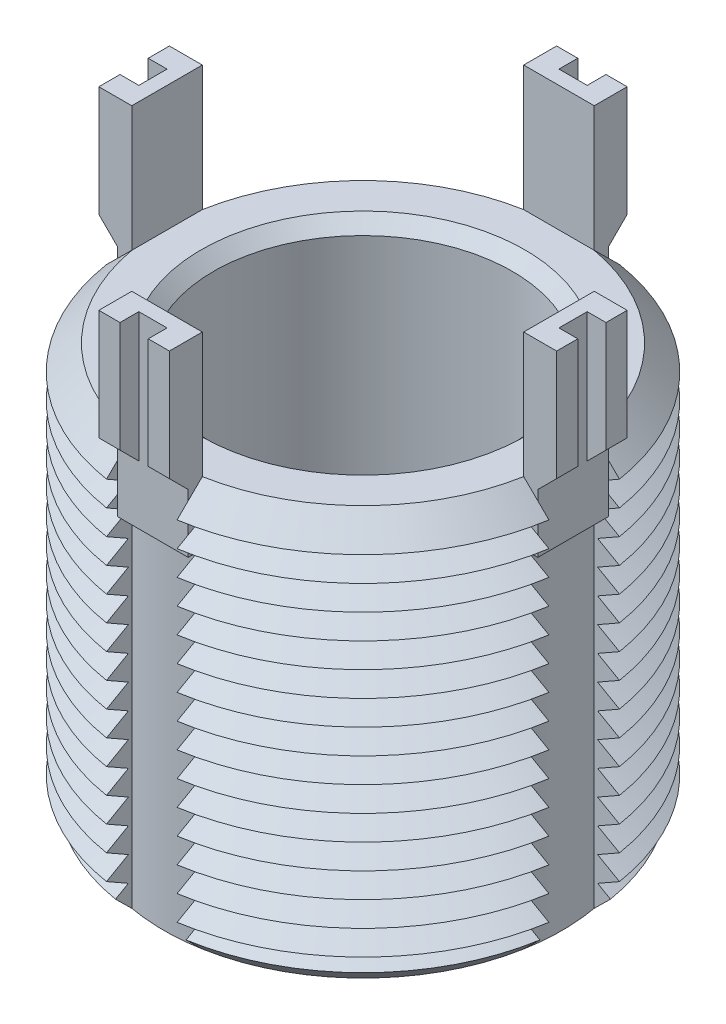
SolidWorks part; units mm, degrees
ref_plane "Front Plane" through (0, 0, 0) normal (0, 0, 1) x (1, 0, 0)
ref_plane "Top Plane" through (0, 0, 0) normal (0, 1, 0) x (1, 0, 0)
ref_plane "Right Plane" through (0, 0, 0) normal (1, 0, 0) x (0, 0, -1)
sketch "Sketch1" plane through (0, 0, 0) normal (0, 1, 0) x (1, 0, 0)
  circle A0 centre (0, 0) radius 19.05
  dimension "D1" = 38.1
extrude "Boss-Extrude1" add sketch "Sketch1" against normal blind 34.798
chamfer "Chamfer1" distance 2.117 angle 45 2 edges at (0, -34.798, 19.05) (0, 0, 19.05)
sketch "Sketch2" plane through (0, 0, 0) normal (1, 0, 0) x (0, 0, -1)
  line L0 (0, 0.8859) -> (0, -9.2617) construction
sketch "Sketch3" plane through (0, 0, 0) normal (1, 0, 0) x (0, 0, -1)
  line L0 (-19.05, -2.117) -> (-17.2166, -3.1755)
  line L1 (-17.2166, -3.1755) -> (-19.05, -4.234)
  line L2 (-19.05, -2.117) -> (-19.05, -32.681) construction
  line L3 (-19.05, -4.234) -> (-19.05, -2.117)
  dimension "D1" = 2.117
revolve "Cut-Revolve1" cut sketch "Sketch3" angle 360 about L0
pattern_linear "LPattern1" count 15 spacing 2.117 along (0, -1, 0) of "Cut-Revolve1"
sketch "Sketch4" plane through (0, 0, 0) normal (0, 1, 0) x (1, 0, 0)
  line L0 (-16.6651, 3) -> (-18.8123, 3)
  line L2 (-18.8123, -3) -> (-16.6651, -3)
  arc A0 (-16.6651, 3) -> (-16.6651, -3) centre (0, 0) ccw
  arc A1 (-18.8123, 3) -> (-18.8123, -3) centre (0, 0) ccw
  circle A2 centre (0, 0) radius 19.05 construction
  circle A3 centre (0, 0) radius 16.933 construction
  point P1 (-16.933, 0)
  point P3 (-19.05, 0)
  point P13 (0, 0)
  dimension "D1" = 6
extrude "Cut-Extrude1" cut sketch "Sketch4" against normal up to surface (34.798 mm away)
pattern_circular "CirPattern1" count 4 over 360 about axis through (0, 0, 0) along (0, 1, 0) of "Cut-Extrude1"
sketch "Sketch5" plane through (0, 0, 0) normal (1, 0, 0) x (0, 0, -1)
  line L0 (-16.6651, 10.649) -> (-16.6651, -5.351)
  line L1 (-16.6651, -5.351) -> (-17.8651, -5.351)
  line L2 (-17.8651, -5.351) -> (-17.8651, -0.351)
  line L3 (-17.8651, -0.351) -> (-19.4651, 1.249)
  line L4 (-19.4651, 1.249) -> (-19.4651, 10.649)
  line L5 (-19.4651, 10.649) -> (-16.6651, 10.649)
  line L6 (-18.8123, -6.351) -> (-3, -6.351) construction
  point P9 (-3, 0)
  point P10 (-17.8651, -0.351)
  dimension "D1" = 1
  dimension "D2" = 16
  dimension "D3" = 11
  dimension "D4" = 2.8
  dimension "D5" = 1.2
  dimension "D6" = 45
extrude "Boss-Extrude3" add sketch "Sketch5" along normal mid plane 6
pattern_circular "CirPattern2" count 4 over 360 about axis through (0, 0, 0) along (0, 1, 0) of "Boss-Extrude3"
sketch "Sketch6" plane through (0, 10.649, 0) normal (0, 1, 0) x (1, 0, 0)
  line L0 (-19.4651, -3) -> (-19.4651, 3) construction
  line L1 (-19.4651, -1.2) -> (-17.8651, -1.2)
  line L2 (-19.4651, -1.2) -> (-19.4651, 1.2)
  line L3 (-19.4651, 1.2) -> (-17.8651, 1.2)
  line L4 (-17.8651, -1.2) -> (-17.8651, 1.2)
  line L5 (-19.4651, -1.2) -> (-17.8651, 1.2) construction
  line L6 (-19.4651, 1.2) -> (-17.8651, -1.2) construction
  line L7 (19.4651, 3) -> (19.4651, -3) construction
  line L8 (-1.2, 17.8651) -> (1.2, 17.8651)
  line L9 (-1.2, 17.8651) -> (-1.2, 19.4651)
  line L10 (-1.2, 19.4651) -> (1.2, 19.4651)
  line L11 (1.2, 17.8651) -> (1.2, 19.4651)
  line L12 (-1.2, 17.8651) -> (1.2, 19.4651) construction
  line L13 (-1.2, 19.4651) -> (1.2, 17.8651) construction
  line L14 (17.8651, -1.2) -> (19.4651, -1.2)
  line L15 (17.8651, -1.2) -> (17.8651, 1.2)
  line L16 (17.8651, 1.2) -> (19.4651, 1.2)
  line L17 (19.4651, -1.2) -> (19.4651, 1.2)
  line L18 (17.8651, -1.2) -> (19.4651, 1.2) construction
  line L19 (17.8651, 1.2) -> (19.4651, -1.2) construction
  line L20 (-1.2, -19.4651) -> (1.2, -19.4651)
  line L21 (-1.2, -19.4651) -> (-1.2, -17.8651)
  line L22 (-1.2, -17.8651) -> (1.2, -17.8651)
  line L23 (1.2, -19.4651) -> (1.2, -17.8651)
  line L24 (-1.2, -19.4651) -> (1.2, -17.8651) construction
  line L25 (-1.2, -17.8651) -> (1.2, -19.4651) construction
  line L26 (-3, 19.4651) -> (3, 19.4651) construction
  line L27 (3, -19.4651) -> (-3, -19.4651) construction
  point P0 (-18.6651, 0)
  point P7 (-19.4651, 0)
  point P8 (-19.4651, 0)
  point P9 (0, 18.6651)
  point P14 (18.6651, 0)
  point P19 (0, -18.6651)
  point P24 (0, 19.4651)
  point P25 (19.4651, 0)
  point P26 (19.4651, 0)
  point P27 (0, 19.4651)
  point P30 (0, -19.4651)
  point P33 (0, -19.4651)
  dimension "D1" = 2.4
  dimension "D2" = 1.6
extrude "Cut-Extrude3" cut sketch "Sketch6" against normal through all both and the other way through all
sketch "Sketch7" plane through (0, 0, 0) normal (0, 1, 0) x (1, 0, 0)
  circle A0 centre (0, 0) radius 12.7
  dimension "D1" = 25.4
extrude "Cut-Extrude4" cut sketch "Sketch7" against normal up to surface (34.798 mm away)
chamfer "Chamfer2" distance 1.0585 angle 45 2 edges at (0, 0, 12.7) (0, -34.798, 12.7)
